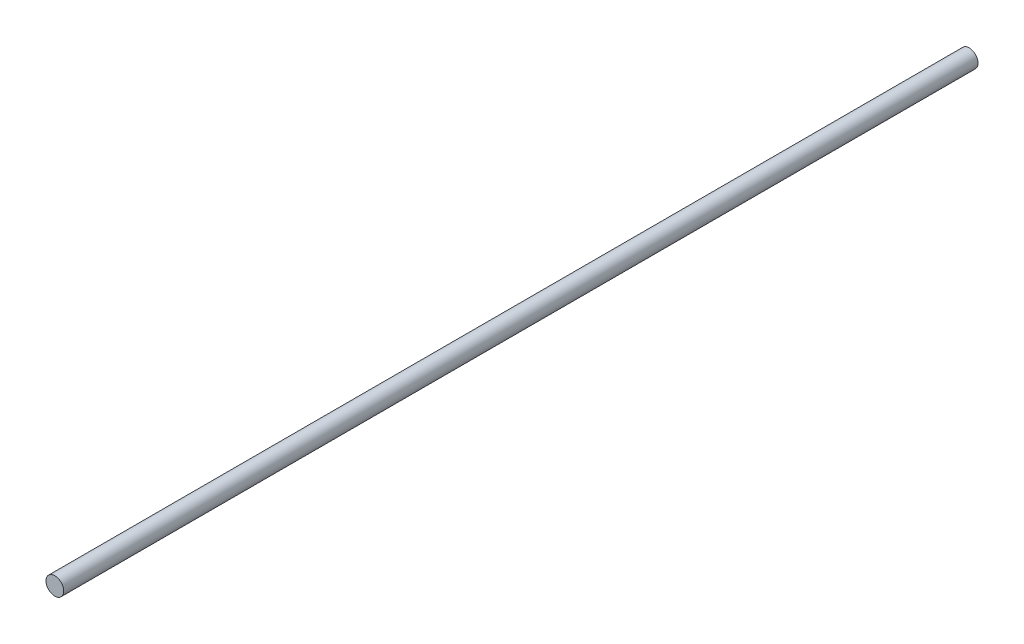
SolidWorks part; units mm, degrees
ref_plane "Front Plane" through (0, 0, 0) normal (0, 0, 1) x (1, 0, 0)
ref_plane "Top Plane" through (0, 0, 0) normal (0, 1, 0) x (1, 0, 0)
ref_plane "Right Plane" through (0, 0, 0) normal (1, 0, 0) x (0, 0, -1)
sketch "Sketch1" plane through (0, 0, 0) normal (0, 0, 1) x (1, 0, 0)
  circle A0 centre (0, 0) radius 30
  dimension "D1" = 60
extrude "Boss-Extrude1" add sketch "Sketch1" against normal blind 3100
